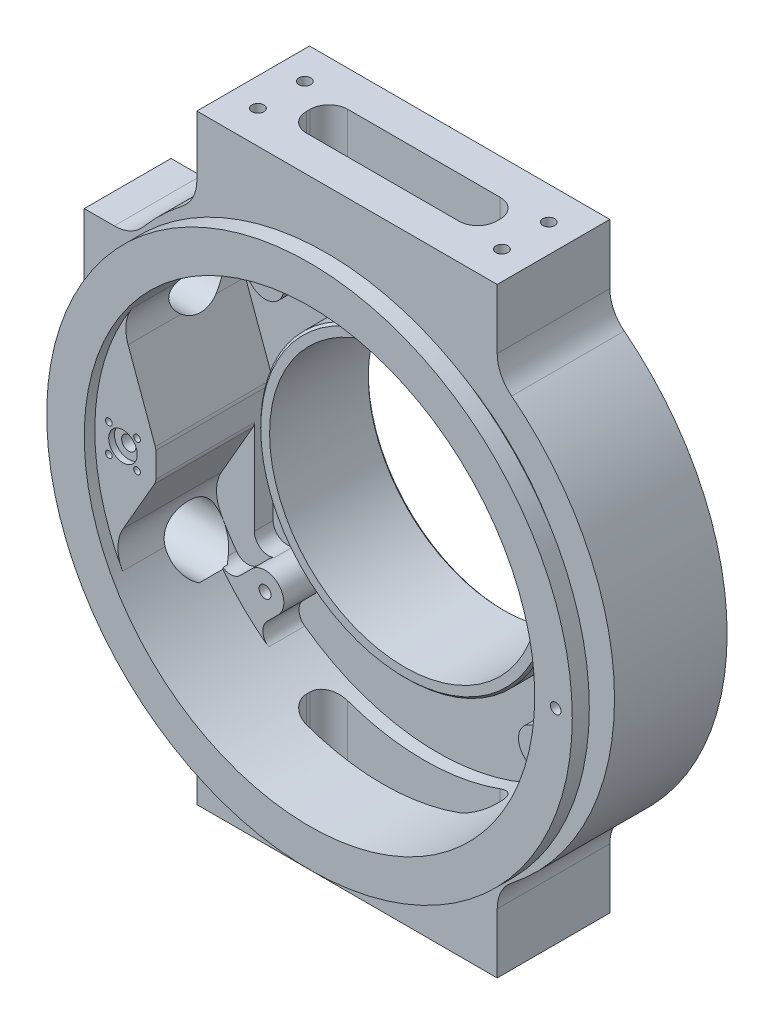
SolidWorks part; units mm, degrees
ref_plane "Front" through (0, 0, 0) normal (0, 0, 1) x (1, 0, 0)
ref_plane "Top" through (0, 0, 0) normal (0, 1, 0) x (1, 0, 0)
ref_plane "Right" through (0, 0, 0) normal (1, 0, 0) x (0, 0, -1)
sketch "Sketch1" plane through (0, 0, 0) normal (0, 0, 1) x (1, 0, 0)
  line L0 (82.55, 0) -> (0, 0) construction
  line L1 (-82.55, 101.6) -> (82.55, 101.6) construction
  line L2 (-82.55, 101.6) -> (-82.55, -101.6) construction
  line L3 (-82.55, -101.6) -> (82.55, -101.6) construction
  line L4 (82.55, 101.6) -> (82.55, -101.6) construction
  line L5 (0, 0) -> (0, 101.6) construction
  line L6 (52.3634, 101.6) -> (-52.3634, 101.6)
  line L8 (-52.3634, -101.6) -> (52.3634, -101.6)
  circle A0 centre (0, 0) radius 76.327 construction
  arc A1 (-52.3634, 101.6) -> (-52.3634, -101.6) centre (0, 0) ccw
  arc A2 (52.3634, -101.6) -> (52.3634, 101.6) centre (0, 0) ccw
  dimension "D3" = 152.654
  dimension "D4" = 228.6
  dimension "D1" = 203.2
  dimension "D2" = 165.1
extrude "Boss-Extrude1" add sketch "Sketch1" along normal mid plane 38.1
sketch "Sketch3" plane through (0, 0, 19.05) normal (0, 0, 1) x (1, 0, 0)
  circle A0 centre (0, 0) radius 74.2188
  circle A1 centre (0, 0) radius 76.327 construction
  dimension "D1" = 2.1082
extrude "Cut-Extrude2" cut sketch "Sketch3" against normal through all
sketch "Sketch4" plane through (0, 0, 0) normal (0, 1, 0) x (1, 0, 0)
  line L0 (52.3634, -19.05) -> (114.3, -19.05) construction
  line L1 (76.2, -31.75) -> (76.2, -28.1788)
  line L2 (76.2, -28.1788) -> (74.2188, -28.1788)
  line L3 (0, 0) -> (30.5583, 0) construction
  line L4 (50.8, 19.05) -> (50.8, 22.5174)
  line L5 (50.8, 22.5174) -> (60.325, 25.9842)
  line L6 (0, 0) -> (0, 54.6666) construction
  line L7 (60.325, 25.9842) -> (60.325, 31.75)
  line L8 (60.325, 31.75) -> (50.8, 31.75)
  line L9 (45.6438, 33.782) -> (45.6438, 19.05)
  line L10 (45.6438, 19.05) -> (50.8, 19.05)
  line L11 (50.038, 34.544) -> (46.4058, 34.544)
  line L12 (50.8, 31.75) -> (50.8, 33.782)
  line L13 (114.3, 19.05) -> (52.3634, 19.05) construction
  line L14 (50.8, 33.782) -> (50.038, 34.544)
  line L15 (46.4058, 34.544) -> (45.6438, 33.782)
  line L20 (74.2188, -19.05) -> (79.375, -19.05)
  line L21 (74.2188, -28.1788) -> (74.2188, -19.05)
  line L22 (88.9, -31.75) -> (76.2, -31.75)
  line L23 (88.9, -25.9842) -> (88.9, -31.75)
  line L24 (79.375, -22.5174) -> (88.9, -25.9842)
  line L25 (79.375, -19.05) -> (79.375, -22.5174)
  point P14 (45.6438, 34.544)
  point P16 (50.8, 34.544)
  dimension "D1" = 5.1562
  dimension "D2" = 5.7658
  dimension "D3" = 177.8
  dimension "D4" = 9.2326
  dimension "D5" = 12.7
  dimension "D6" = 14.6812
  dimension "D7" = 20
  dimension "D8" = 1.9812
  dimension "D9" = 3.5712
  dimension "D10" = 5.1562
  dimension "D11" = 12.7
  dimension "D12" = 5.7658
  dimension "D13" = 2.794
  dimension "D14" = 20
  dimension "D15" = 9.2326
  dimension "D16" = 101.6
  dimension "D17" = 14.6812
  dimension "D18" = 120.65
  dimension "D19" = 148.4376
  dimension "D20" = 152.4
revolve "Revolve1" add sketch "Sketch4" angle 360 mid plane about L6
sketch "Sketch5" plane through (0, 0, -19.05) normal (0, 0, 1) x (1, 0, 0)
  circle A0 centre (0, 0) radius 45.6438 construction
  circle A1 centre (0, 0) radius 45.6438
  circle A2 centre (0, 0) radius 74.2188 construction
  circle A3 centre (0, 0) radius 74.2188
extrude "Boss-Extrude2" add sketch "Sketch5" along normal up to surface (47.2288 mm away)
sketch "Sketch6" plane through (0, 0, 0) normal (0, 1, 0) x (1, 0, 0)
  line L0 (32.1437, -0.635) -> (32.1437, 0.635) construction
  line L1 (-25.7937, -6.985) -> (25.7937, -6.985) construction
  line L2 (25.7937, 6.985) -> (-25.7937, 6.985) construction
  line L3 (-32.1437, 0.635) -> (-32.1437, -0.635) construction
  line L4 (32.1437, -0.635) -> (32.1437, 0.635)
  line L5 (-25.7937, -6.985) -> (25.7937, -6.985)
  line L6 (25.7937, 6.985) -> (-25.7937, 6.985)
  line L7 (-32.1437, 0.635) -> (-32.1437, -0.635)
  arc A0 (25.7937, -6.985) -> (32.1437, -0.635) centre (25.7937, -0.635) ccw construction
  arc A1 (32.1437, 0.635) -> (25.7937, 6.985) centre (25.7937, 0.635) ccw construction
  arc A2 (-25.7937, 6.985) -> (-32.1437, 0.635) centre (-25.7937, 0.635) ccw construction
  arc A3 (-32.1437, -0.635) -> (-25.7937, -6.985) centre (-25.7937, -0.635) ccw construction
  arc A4 (25.7937, -6.985) -> (32.1437, -0.635) centre (25.7937, -0.635) ccw
  arc A5 (32.1437, 0.635) -> (25.7937, 6.985) centre (25.7937, 0.635) ccw
  arc A6 (-25.7937, 6.985) -> (-32.1437, 0.635) centre (-25.7937, 0.635) ccw
  arc A7 (-32.1437, -0.635) -> (-25.7937, -6.985) centre (-25.7937, -0.635) ccw
extrude "Cut-Extrude3" cut sketch "Sketch6" against normal mid plane 228.6
hole_wizard "#10-32 Tapped Hole1" positions "Sketch8" profile "Sketch7" tap size "#10-32" standard "Ansi Inch"
sketch "Sketch8" plane through (0, 101.6, 0) normal (0, 1, 0) x (-1, 0, 0)
  point P0 (-41.275, 7.9375)
  point P1 (-41.275, -7.9375)
  point P4 (41.275, -7.9375)
  point P7 (41.275, 7.9375)
sketch "Sketch7" plane through (41.275, 101.6, 7.9375) normal (1, 0, 0) x (0, 0, 1)
  line L0 (0, 0) -> (0, 17.9773)
  line L1 (0, 17.9773) -> (2.0193, 16.764)
  line L2 (2.0193, 16.764) -> (2.0193, 0)
  line L5 (2.0193, 0) -> (0, 0)
  line L10 (0, 17.9773) -> (-2.0193, 16.764) construction
  line L11 (0, -6.35) -> (0, 107.95) construction
  dimension "Tap Drill Dia." = 4.0386
  dimension "Tap Drill Depth" = 16.764
  dimension "Drill Angle" = 118
hole_wizard "#10-32 Tapped Hole2" positions "Sketch10" profile "Sketch9" tap size "#10-32" standard "Ansi Inch"
sketch "Sketch10" plane through (0, -101.6, 0) normal (0, -1, 0) x (1, 0, 0)
  point P0 (41.275, -7.9375)
  point P1 (-41.275, 7.9375)
  point P4 (-41.275, -7.9375)
  point P7 (41.275, 7.9375)
sketch "Sketch9" plane through (41.275, -101.6, -7.9375) normal (1, 0, 0) x (0, 0, -1)
  line L0 (0, 0) -> (0, 17.9773)
  line L1 (0, 17.9773) -> (2.0193, 16.764)
  line L2 (2.0193, 16.764) -> (2.0193, 0)
  line L5 (2.0193, 0) -> (0, 0)
  line L10 (0, 17.9773) -> (-2.0193, 16.764) construction
  line L11 (0, -6.35) -> (0, 107.95) construction
  dimension "Tap Drill Dia." = 4.0386
  dimension "Tap Drill Depth" = 16.764
  dimension "Drill Angle" = 118
sketch "Sketch11" plane through (0, 0, 28.1788) normal (0, 0, 1) x (1, 0, 0)
  circle A0 centre (-66.675, 0) radius 2.3813 construction
  circle A1 centre (-66.675, 0) radius 2.3813
sketch "Sketch15" plane through (0, 0, 19.05) normal (0, 0, 1) x (1, 0, 0)
  line L0 (50.8, 101.6) -> (50.8, 81.3352)
  line L1 (0, 0) -> (28.4177, 0) construction
  line L2 (0, 0) -> (0, 27.3386) construction
  line L3 (50.8, -101.6) -> (-50.8, -101.6)
  line L4 (-50.8, -101.6) -> (-50.8, -81.3352)
  line L5 (-50.8, 101.6) -> (-50.8, 81.3352)
  line L6 (52.3634, 101.6) -> (-52.3634, 101.6) construction
  line L7 (-52.3634, -101.6) -> (52.3634, -101.6) construction
  line L8 (50.8, 101.6) -> (-50.8, 101.6)
  line L9 (50.8, -101.6) -> (50.8, -81.3352)
  line L11 (-101.6, 53.975) -> (-101.6, -53.975)
  line L12 (-101.6, -53.975) -> (-78.7534, -53.975)
  line L13 (-101.6, 53.975) -> (-78.7534, 53.975)
  arc A0 (-55.6846, 71.3247) -> (-69.0607, 58.4688) centre (0, 0) ccw
  arc A1 (55.6846, -71.3247) -> (55.6846, 71.3247) centre (0, 0) ccw
  arc A2 (-50.8, -81.3352) -> (-55.6846, -71.3247) centre (-63.5, -81.3352) ccw
  arc A3 (50.8, -81.3352) -> (55.6846, -71.3247) centre (63.5, -81.3352) cw
  arc A4 (55.6846, 71.3247) -> (50.8, 81.3352) centre (63.5, 81.3352) cw
  arc A5 (-50.8, 81.3352) -> (-55.6846, 71.3247) centre (-63.5, 81.3352) cw
  arc A6 (-69.0607, -58.4688) -> (-55.6846, -71.3247) centre (0, 0) ccw
  arc A7 (-78.7534, -53.975) -> (-69.0607, -58.4688) centre (-78.7534, -66.675) cw
  arc A8 (-69.0607, 58.4688) -> (-78.7534, 53.975) centre (-78.7534, 66.675) cw
  dimension "D1" = 180.975
  dimension "D2" = 12.7
  dimension "D6" = 12.7
  dimension "D3" = 50.8
  dimension "D4" = 53.975
  dimension "D5" = 107.95
  dimension "D7" = 101.6
extrude "Cut-Extrude7" cut sketch "Sketch15" against normal blind 41.275 flip side to cut
sketch "Sketch12" plane through (0, 0, -19.05) normal (0, 0, -1) x (-1, 0, 0)
  line L0 (0, 0) -> (120.65, 0) construction
  line L1 (120.65, 82.55) -> (88.9, 82.55)
  line L2 (120.65, 82.55) -> (120.65, -82.55)
  line L3 (120.65, -82.55) -> (88.9, -82.55)
  line L4 (88.9, 82.55) -> (88.9, 77.8842)
  line L5 (65.6665, -6.1336) -> (88.9, -12.359)
  line L6 (101.6, 52.3634) -> (101.6, -52.3634) construction
  line L7 (88.9, 77.8842) -> (61.343, 2.1718)
  line L8 (88.9, -12.359) -> (88.9, -82.55)
  line L9 (66.675, 0) -> (109.7618, 70.3113) construction
  line L10 (66.675, 0) -> (145.4194, -6.1973) construction
  line L11 (66.4882, -2.3739) -> (145.2326, -8.5712) construction
  line L12 (64.6447, 1.2442) -> (107.7315, 71.5555) construction
  arc A0 (65.6665, -6.1336) -> (61.343, 2.1718) centre (67.31, 0) cw
  point P10 (59.9777, 0)
  dimension "D5" = 6.35
  dimension "D2" = 60.96
  dimension "D1" = 165.1
  dimension "D3" = 70
  dimension "D4" = 120.65
  dimension "D6" = 12.7
  dimension "D7" = 58.5
  dimension "D8" = 4.5
  dimension "D11" = 15
  dimension "D9" = 2.3813
  dimension "D10" = 2.3813
extrude "ROD POCKET" cut sketch "Sketch12" against normal blind 8.7312
sketch "Sketch27" plane through (0, 0, -19.05) normal (0, 0, -1) x (-1, 0, 0)
  line L0 (60.96, 0) -> (60.96, -70.7603)
  line L1 (60.96, -70.7603) -> (88.9, -66.1783)
  line L2 (65.6665, -6.1336) -> (88.9, -12.359) construction
  line L3 (88.9, -12.359) -> (88.9, -53.975) construction
  line L4 (65.6665, -6.1336) -> (88.9, -12.359)
  line L5 (88.9, -12.359) -> (88.9, -66.1783)
  arc A0 (61.343, 2.1718) -> (65.6665, -6.1336) centre (67.31, 0) ccw construction
  arc A1 (60.96, 0) -> (65.6665, -6.1336) centre (67.31, 0) ccw
extrude "Cut-Extrude11" cut sketch "Sketch27" against normal up to surface (8.7312 mm away)
sketch "Sketch13" plane through (0, 0, 28.1788) normal (0, 0, 1) x (1, 0, 0)
  circle A0 centre (-66.675, 0) radius 2.413
  dimension "D1" = 4.826
extrude "Cut-Extrude5" cut sketch "Sketch13" against normal up to surface (47.2288 mm away)
sketch "Sketch14" plane through (0, 0, 28.1788) normal (0, 0, 1) x (1, 0, 0)
  line L1 (-66.675, 0) -> (0, 0) construction
  line L2 (-55.9879, -5.6959) -> (-66.6689, -24.196)
  line L3 (-64.9404, 30.6218) -> (-55.754, 5.3824)
  line L4 (-55.5625, 4.2965) -> (-55.5625, -4.1084)
  line L5 (-80.1978, 53.975) -> (-61.343, 2.1718) construction
  arc A0 (-55.5625, -4.1084) -> (-55.9879, -5.6959) centre (-58.7375, -4.1084) cw
  circle A1 centre (0, 0) radius 76.2
  arc A2 (-66.8044, -36.6552) -> (-63.6075, 41.9586) centre (0, 0) ccw
  arc A3 (-66.6689, -24.196) -> (-66.8044, -36.6552) centre (-55.6704, -30.546) ccw
  arc A4 (-64.9404, 30.6218) -> (-63.6075, 41.9586) centre (-53.0063, 34.9655) cw
  arc A5 (-55.754, 5.3824) -> (-55.5625, 4.2965) centre (-58.7375, 4.2965) cw
  circle A6 centre (-66.675, 0) radius 12.1033 construction
  point P10 (-70.0348, -30.026)
  point P13 (-70.0348, 30.026)
  dimension "D2" = 6.35
  dimension "D4" = 12.7
  dimension "D3" = 3.175
  dimension "D5" = 60
  dimension "D6" = 11.1125
  dimension "D7" = 70
  dimension "D1" = 0
extrude "Cut-Extrude6" cut sketch "Sketch14" against normal blind 39.6875
sketch "Sketch16" plane through (0, 0, 28.1788) normal (0, 0, 1) x (1, 0, 0)
  circle A0 centre (-66.675, 0) radius 4.826
  circle A1 centre (-66.675, 0) radius 2.413 construction
  dimension "D1" = 9.652
extrude "Cut-Extrude8" cut sketch "Sketch16" against normal blind 1.9558
sketch "Sketch17" plane through (0, 0, -19.05) normal (0, 0, -1) x (-1, 0, 0)
  line L0 (101.6, 52.3875) -> (101.6, -52.3875)
  line L1 (73.7803, 52.3875) -> (101.6, 52.3875)
  line L2 (73.7803, -52.3875) -> (101.6, -52.3875)
  arc A0 (69.0607, 58.4688) -> (55.6846, 71.3247) centre (0, 0) ccw construction
  arc A1 (69.0607, 58.4688) -> (55.6846, 71.3247) centre (0, 0) ccw construction
  arc A2 (69.0607, 58.4688) -> (55.6846, 71.3247) centre (0, 0) ccw construction
  arc A3 (73.7803, -52.3875) -> (73.7803, 52.3875) centre (0, 0) ccw
  dimension "D1" = 101.6
  dimension "D2" = 104.775
  dimension "D3" = 52.3875
extrude "Boss-Extrude3" [suppressed] add sketch "Sketch17" against normal up to vertex
chamfer "Chamfer1" distance 3.175 angle 45 1 edges at (-64.262, 0, -10.3187)
sketch "Sketch19" plane through (0, 0, -10.3187) normal (0, 0, -1) x (-1, 0, 0)
  line L0 (66.675, 0) -> (146.05, 0) construction
  line L4 (66.675, 0) -> (142.1651, 24.5282) construction
  line L5 (66.675, 0) -> (130.8907, 46.6555) construction
  line L6 (66.675, 0) -> (113.3305, 64.2157) construction
  line L7 (66.675, 0) -> (145.8053, -6.2277) construction
  line L9 (108.1483, 67.6783) -> (66.675, 0) construction
  circle A0 centre (66.675, 0) radius 2.413 construction
  arc A1 (145.8053, -6.2277) -> (108.1483, 67.6783) centre (66.675, 0) ccw construction
  dimension "D3" = 158.75
  dimension "D2" = 18
  dimension "D4" = 4.5
  dimension "D5" = 4.5
  dimension "D1" = 4
sketch "Sketch22" plane through (0, 0, -11.5087) normal (0, 0, 1) x (1, 0, 0)
  line L0 (50.5276, -41.5474) -> (54.3892, -45.4089)
  line L1 (50.5276, -41.5474) -> (41.5474, -50.5276) construction
  line L2 (45.4089, -54.3892) -> (41.5474, -50.5276)
  line L3 (46.0375, -46.0375) -> (-46.0375, 46.0375) construction
  line L4 (46.0375, 46.0375) -> (-46.0375, -46.0375) construction
  line L5 (0, 0) -> (0, -35.1849) construction
  line L6 (0, 0) -> (-30.9427, 0) construction
  line L7 (-45.4089, -54.3892) -> (-41.5474, -50.5276)
  line L10 (-50.5276, -41.5474) -> (-54.3892, -45.4089)
  line L11 (-50.5276, 41.5474) -> (-54.3892, 45.4089)
  line L12 (-45.4089, 54.3892) -> (-41.5474, 50.5276)
  line L13 (50.5276, 41.5474) -> (54.3892, 45.4089)
  line L14 (45.4089, 54.3892) -> (41.5474, 50.5276)
  arc A0 (-60.96, -45.72) -> (-63.6075, 41.9586) centre (0, 0) ccw construction
  arc A1 (50.5276, -41.5474) -> (41.5474, -50.5276) centre (46.0375, -46.0375) ccw
  arc A2 (-44.8441, -61.6072) -> (-45.4089, -54.3892) centre (-42.0413, -57.7568) cw
  arc A5 (-50.5276, -41.5474) -> (-41.5474, -50.5276) centre (-46.0375, -46.0375) cw
  arc A6 (61.6072, -44.8441) -> (54.3892, -45.4089) centre (57.7568, -42.0413) cw
  arc A7 (44.8441, -61.6072) -> (45.4089, -54.3892) centre (42.0413, -57.7568) ccw
  arc A8 (-61.6072, -44.8441) -> (-54.3892, -45.4089) centre (-57.7568, -42.0413) ccw
  arc A9 (-44.8441, -61.6072) -> (-61.6072, -44.8441) centre (0, 0) cw
  arc A10 (-61.6072, 44.8441) -> (-54.3892, 45.4089) centre (-57.7568, 42.0413) cw
  arc A15 (-44.8441, 61.6072) -> (-61.6072, 44.8441) centre (0, 0) ccw
  arc A16 (44.8441, -61.6072) -> (61.6072, -44.8441) centre (0, 0) ccw
  arc A17 (-44.8441, 61.6072) -> (-45.4089, 54.3892) centre (-42.0413, 57.7568) ccw
  arc A18 (-50.5276, 41.5474) -> (-41.5474, 50.5276) centre (-46.0375, 46.0375) ccw
  arc A19 (61.6072, 44.8441) -> (54.3892, 45.4089) centre (57.7568, 42.0413) ccw
  arc A20 (44.8441, 61.6072) -> (61.6072, 44.8441) centre (0, 0) cw
  arc A21 (44.8441, 61.6072) -> (45.4089, 54.3892) centre (42.0413, 57.7568) cw
  arc A22 (50.5276, 41.5474) -> (41.5474, 50.5276) centre (46.0375, 46.0375) cw
  dimension "D1" = 12.7
  dimension "D4" = 4.7625
  dimension "D5" = 90
  dimension "D2" = 45
  dimension "D3" = 90
  dimension "D6" = 46.0375
  dimension "D7" = 46.0375
extrude "Boss-Extrude4" add sketch "Sketch22" along normal blind 12.2428
hole_wizard "#10-32 Tapped Hole3" positions "Sketch21" profile "Sketch20" tap size "#10-32" standard "Ansi Inch"
sketch "Sketch21" plane through (42.0212, -48.2701, 0.7341) normal (0, 0, 1) x (1, 0, 0)
  point P1 (4.0163, 94.3076)
  point P4 (4.0163, 2.2326)
  point P7 (-88.0587, 2.2326)
  point P10 (-88.0587, 94.3076)
sketch "Sketch20" plane through (46.0375, 46.0375, 0.7341) normal (1, 0, 0) x (0, -1, 0)
  line L0 (0, 0) -> (0, 12.7)
  line L1 (0, 12.7) -> (2.0193, 12.7)
  line L2 (2.0193, 12.7) -> (2.0193, 0)
  line L5 (2.0193, 0) -> (0, 0)
  line L10 (0, 12.7) -> (-2.0193, 12.7) construction
  line L11 (0, -6.35) -> (0, 107.95) construction
  dimension "Tap Drill Dia." = 4.0386
  dimension "Tap Drill Depth" = 12.7
  dimension "Drill Angle" = 180
sketch "Sketch23" plane through (-101.6, 0, 0) normal (-1, 0, 0) x (0, 0, 1)
  line L0 (4.3656, -53.975) -> (4.3656, 53.975) construction
  line L1 (-10.3187, -53.975) -> (19.05, -53.975) construction
  line L2 (-10.3187, 53.975) -> (19.05, 53.975) construction
  circle A0 centre (4.3656, -38.1) radius 6.35
  circle A1 centre (4.3656, 38.1) radius 6.35
  dimension "D1" = 12.7
  dimension "D2" = 38.1
  dimension "D3" = 38.1
extrude "Cut-Extrude9" cut sketch "Sketch23" against normal blind 41.275
ref_plane "Plane1" through (-88.9, 0, 0) normal (-1, 0, 0) x (0, 0, 1)
hole_wizard "#4-40 Tapped Hole1" positions "Sketch26" profile "Sketch25" tap size "#4-40" standard "Ansi Inch"
sketch "Sketch26" plane through (0, 0, 28.1788) normal (0, 0, 1) x (1, 0, 0)
  point P0 (-71.4375, -4.7625)
  point P1 (-71.4375, 4.7625)
  point P4 (-61.9125, 4.7625)
  point P7 (-61.9125, -4.7625)
sketch "Sketch25" plane through (-71.4375, -4.7625, 28.1788) normal (1, 0, 0) x (0, -1, 0)
  line L0 (0, 0) -> (0, 12.1092)
  line L1 (0, 12.1092) -> (1.1303, 11.43)
  line L2 (1.1303, 11.43) -> (1.1303, 0)
  line L5 (1.1303, 0) -> (0, 0)
  line L10 (0, 12.1092) -> (-1.1303, 11.43) construction
  line L11 (0, -6.35) -> (0, 107.95) construction
  dimension "Tap Drill Dia." = 2.2606
  dimension "Tap Drill Depth" = 11.43
  dimension "Drill Angle" = 118
sketch "Sketch28" plane through (0, 0, -10.3187) normal (0, 0, 1) x (1, 0, 0)
  line L1 (-55.9879, -5.6959) -> (-66.6689, -24.196) construction
  line L2 (-55.5625, -4.1084) -> (-55.5625, -35.9973)
  line L4 (-55.9879, -5.6959) -> (-66.6689, -24.196)
  line L12 (-50.5276, -41.5474) -> (-54.3892, -45.4089) construction
  line L13 (-50.5276, -41.5474) -> (-54.3892, -45.4089)
  arc A0 (-66.6689, -24.196) -> (-66.8044, -36.6552) centre (-55.6704, -30.546) ccw construction
  arc A1 (-55.9879, -5.6959) -> (-55.5625, -4.1084) centre (-58.7375, -4.1084) ccw construction
  arc A2 (-66.6689, -24.196) -> (-66.8044, -36.6552) centre (-55.6704, -30.546) ccw
  circle A3 centre (0, 0) radius 76.2 construction
  arc A6 (-55.9879, -5.6959) -> (-55.5625, -4.1084) centre (-58.7375, -4.1084) ccw
  arc A8 (-61.6072, -44.8441) -> (-54.3892, -45.4089) centre (-57.7568, -42.0413) ccw construction
  arc A9 (-66.8044, -36.6552) -> (-61.6072, -44.8441) centre (0, 0) ccw
  arc A10 (-61.6072, -44.8441) -> (-54.3892, -45.4089) centre (-57.7568, -42.0413) ccw
  arc A11 (-55.5625, -35.9973) -> (-48.7589, -40.3002) centre (-50.8, -35.9973) ccw
  arc A12 (-41.5474, -50.5276) -> (-50.5276, -41.5474) centre (-46.0375, -46.0375) ccw construction
  arc A13 (-48.7589, -40.3002) -> (-50.5276, -41.5474) centre (-46.0375, -46.0375) ccw
  dimension "D1" = 9.525
extrude "Boss-Extrude5" add sketch "Sketch28" along normal blind 5.1587
sketch "Sketch24" plane through (-88.9, 0, 0) normal (1, 0, 0) x (0, 0, -1)
  circle A2 centre (-4.3656, -38.1) radius 9.525
  circle A3 centre (-4.3656, 38.1) radius 9.525
  circle A4 centre (-4.3656, -38.1) radius 6.35 construction
  circle A5 centre (-4.3656, 38.1) radius 6.35 construction
  dimension "D1" = 19.05
extrude "Cut-Extrude10" cut sketch "Sketch24" along normal blind 28.575
sketch "Sketch30" plane through (0, 0, -11.5087) normal (0, 0, 1) x (1, 0, 0)
  circle A0 centre (0, 0) radius 49.403
  circle A1 centre (0, 0) radius 45.6438 construction
  circle A2 centre (0, 0) radius 45.6438
  dimension "D1" = 98.806
extrude "Boss-Extrude7" add sketch "Sketch30" along normal blind 11.1125
chamfer "Chamfer2" distance 0.762 angle 45 1 edges at (49.403, 0, -0.3962)
sketch "Sketch32" plane through (0, 0, -10.3187) normal (0, 0, -1) x (-1, 0, 0)
  line L0 (60.96, -14.3079) -> (60.96, -45.5656) construction
  line L1 (60.96, -14.3079) -> (60.96, -45.5656)
  line L9 (60.96, -45.72) -> (60.96, -66.872)
  line L10 (78.7534, -53.975) -> (100.7531, -53.975)
  line L11 (101.6, -52.3634) -> (101.6, 52.3634)
  line L12 (100.7531, 53.975) -> (80.1978, 53.975)
  line L13 (80.1978, 53.975) -> (61.343, 2.1718)
  line L14 (60.96, 0) -> (60.96, -14.3079)
  line L15 (60.96, -14.3079) -> (55.9879, -5.6959)
  line L16 (55.5625, -4.1084) -> (55.5625, -35.9973)
  line L17 (50.5276, -41.5474) -> (54.3892, -45.4089)
  line L24 (60.96, -14.3079) -> (55.9879, -5.6959)
  line L25 (55.5625, -4.1084) -> (55.5625, -35.9973)
  line L26 (50.5276, -41.5474) -> (54.3892, -45.4089)
  arc A10 (54.3892, -45.4089) -> (61.6072, -44.8441) centre (57.7568, -42.0413) ccw
  arc A11 (60.96, -45.72) -> (61.6072, -44.8441) centre (0, 0) ccw
  arc A12 (60.96, -66.872) -> (69.0607, -58.4688) centre (0, 0) ccw
  arc A13 (78.7534, -53.975) -> (69.0607, -58.4688) centre (78.7534, -66.675) ccw
  arc A14 (100.7531, -53.975) -> (101.6, -52.3634) centre (0, 0) ccw
  arc A15 (101.6, 52.3634) -> (100.7531, 53.975) centre (0, 0) ccw
  arc A16 (61.343, 2.1718) -> (60.96, 0) centre (67.31, 0) ccw
  arc A17 (55.5625, -4.1084) -> (55.9879, -5.6959) centre (58.7375, -4.1084) ccw
  arc A18 (48.7589, -40.3002) -> (55.5625, -35.9973) centre (50.8, -35.9973) ccw
  arc A19 (50.5276, -41.5474) -> (48.7589, -40.3002) centre (46.0375, -46.0375) ccw
  arc A20 (54.3892, -45.4089) -> (60.96, -45.5656) centre (57.7568, -42.0413) ccw
  arc A27 (55.5625, -4.1084) -> (55.9879, -5.6959) centre (58.7375, -4.1084) ccw
  arc A28 (48.7589, -40.3002) -> (55.5625, -35.9973) centre (50.8, -35.9973) ccw
  arc A29 (50.5276, -41.5474) -> (48.7589, -40.3002) centre (46.0375, -46.0375) ccw
  dimension "D1" = 0
extrude "Boss-Extrude8" add sketch "Sketch32" along normal up to vertex (1.19 mm away)
sketch "Sketch33" plane through (0, 0, -10.3187) normal (0, 0, -1) x (-1, 0, 0)
  line L0 (60.96, 0) -> (60.96, -66.872) construction
  line L1 (60.96, -46.5648) -> (62.1591, -46.5648)
  line L2 (60.96, -46.5648) -> (60.96, -43.9294)
  line L3 (60.96, -43.9294) -> (62.1591, -43.9294)
  line L4 (62.1591, -46.5648) -> (62.1591, -43.9294)
extrude "Cut-Extrude12" cut sketch "Sketch33" along normal up to vertex (1.19 mm away)
sketch "Sketch34" plane through (0, 0, -10.3187) normal (0, 0, -1) x (-1, 0, 0)
  line L0 (88.9, -61.3692) -> (88.9, 61.4824)
  dimension "D1" = 88.9
extrude "Cut-Extrude13" cut sketch "Sketch34" against normal through all and the other way through all flip side to cut
hole_wizard "#6-32 Tapped Hole1" positions "Sketch36" profile "Sketch35" tap size "#6-32" standard "Ansi Inch"
sketch "Sketch36" plane through (0, 0, -10.3187) normal (0, 0, -1) x (-1, 0, 0)
  circle A0 centre (66.675, 0) radius 2.413 construction
  point P1 (79.2015, 25.683)
  point P11 (83.0649, -23.4073)
  point P17 (80.0521, -11.2247)
  point P20 (80.0521, 11.2247)
  dimension "D1" = 12.5265
  dimension "D2" = 25.683
  dimension "D3" = 23.4073
  dimension "D4" = 16.3899
  dimension "D5" = 11.2247
  dimension "D6" = 11.2247
  dimension "D7" = 13.3771
sketch "Sketch35" plane through (-79.2015, 25.683, -10.3187) normal (1, 0, 0) x (0, 1, 0)
  line L0 (0, 0) -> (0, 11.7855)
  line L1 (0, 11.7855) -> (1.3525, 10.9728)
  line L2 (1.3525, 10.9728) -> (1.3525, 0)
  line L5 (1.3525, 0) -> (0, 0)
  line L10 (0, 11.7855) -> (-1.3526, 10.9728) construction
  line L11 (0, -6.35) -> (0, 107.95) construction
  dimension "Tap Drill Dia." = 2.7051
  dimension "Tap Drill Depth" = 10.9728
  dimension "Drill Angle" = 118
hole_wizard "#42 (0.0935) Diameter Hole1" positions "Sketch38" profile "Sketch37" hole size "#42" standard "Ansi Inch"
sketch "Sketch38" plane through (0, 0, -10.3187) normal (0, 0, -1) x (-1, 0, 0)
  line L0 (66.675, 0) -> (84.7328, -31.277) construction
  line L2 (84.7328, -31.277) -> (66.675, 0) construction
  line L3 (66.675, 0) -> (84.7328, 31.277) construction
  line L5 (84.7328, 31.277) -> (66.675, 0) construction
  line L7 (66.675, 0) -> (82.7826, 0) construction
  circle A0 centre (66.675, 0) radius 21.0344
  circle A1 centre (66.675, 0) radius 36.1156
  point P0 (77.1922, -18.2163)
  point P1 (77.1922, 18.2163)
  point P3 (84.7328, -31.277)
  point P5 (84.7328, 31.277)
  dimension "D1" = 42.0687
  dimension "D2" = 72.2313
  dimension "D3" = 60
  dimension "D4" = 60
  dimension "D5" = 60
  dimension "D6" = 60
sketch "Sketch37" plane through (-77.1922, -18.2163, -10.3187) normal (1, 0, 0) x (0, 1, 0)
  line L0 (0, 0) -> (0, 5.476)
  line L1 (0, 5.476) -> (1.1874, 4.7625)
  line L2 (1.1874, 4.7625) -> (1.1874, 0)
  line L5 (1.1874, 0) -> (0, 0)
  line L10 (0, 5.476) -> (-1.1875, 4.7625) construction
  line L11 (0, -6.35) -> (0, 107.95) construction
  dimension "Hole Dia." = 2.3749
  dimension "Hole Depth" = 4.7625
  dimension "Drill Angle" = 118
hole_wizard "#10-32 Tapped Hole4" positions "Sketch40" profile "Sketch39" tap size "#10-32" standard "Ansi Inch"
sketch "Sketch40" plane through (-88.9, 0, 0) normal (-1, 0, 0) x (0, 0, 1)
  point P0 (4.3656, -19.05)
  point P1 (4.3656, 19.05)
sketch "Sketch39" plane through (-88.9, -19.05, 4.3656) normal (0, 1, 0) x (0, 0, 1)
  line L0 (0, 0) -> (0, 14.8277)
  line L1 (0, 14.8277) -> (2.0193, 13.6144)
  line L2 (2.0193, 13.6144) -> (2.0193, 0)
  line L5 (2.0193, 0) -> (0, 0)
  line L10 (0, 14.8277) -> (-2.0193, 13.6144) construction
  line L11 (0, -6.35) -> (0, 107.95) construction
  dimension "Tap Drill Dia." = 4.0386
  dimension "Tap Drill Depth" = 13.6144
  dimension "Drill Angle" = 118
sketch "Sketch41" plane through (0, 0, 0) normal (0, 0, 1) x (1, 0, 0)
  line L0 (90.4875, 38.4701) -> (90.4875, -32.2557)
  arc A0 (55.6846, -71.3247) -> (55.6846, 71.3247) centre (0, 0) ccw construction
sketch "Sketch42" plane through (0, 0, 0) normal (0, 1, 0) x (1, 0, 0)
  line L0 (0, -0.7625) -> (0, 42.9015) construction
  line L5 (60.325, 31.75) -> (-60.325, 31.75) construction
  line L7 (50.8, 31.75) -> (54.2274, 31.75)
  line L21 (54.2274, 31.75) -> (54.8291, 29.5043)
  line L23 (50.8, 31.75) -> (50.8, 29.4386)
  line L24 (54.5838, 29.1846) -> (51.054, 29.1846)
  arc A2 (54.8291, 29.5043) -> (54.5838, 29.1846) centre (54.5838, 29.4386) cw
  arc A3 (50.8, 29.4386) -> (51.054, 29.1846) centre (51.054, 29.4386) ccw
  dimension "D28" = 0.254
  dimension "D1" = 75
  dimension "D3" = 3.4274
  dimension "D4" = 2.5654
  dimension "D6" = 101.6
revolve "Cut-Revolve1" cut sketch "Sketch42" angle 360 about L0
sketch "Sketch43" plane through (0, 0, 31.75) normal (0, 0, 1) x (1, 0, 0)
  circle A0 centre (83.312, 0) radius 1.778
  dimension "D2" = 3.556
  dimension "D1" = 83.312
extrude "Cut-Extrude14" cut sketch "Sketch43" against normal blind 9.525
